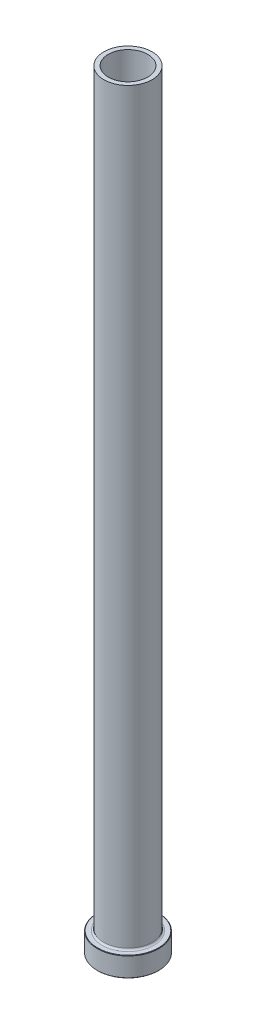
SolidWorks part; units mm, degrees
ref_plane "Front Plane" through (0, 0, 0) normal (0, 0, 1) x (1, 0, 0)
ref_plane "Top Plane" through (0, 0, 0) normal (0, 1, 0) x (1, 0, 0)
ref_plane "Right Plane" through (0, 0, 0) normal (1, 0, 0) x (0, 0, -1)
sketch "Sketch1" plane through (0, 0, 0) normal (0, 0, 1) x (1, 0, 0)
  line L0 (-9, 350) -> (-11, 350)
  line L1 (-11, 350) -> (-11, 9)
  line L2 (-11, 9) -> (-14, 9)
  line L3 (-14, 9) -> (-14, 0)
  line L4 (15.4, 0) -> (-15.4, 0) construction
  line L5 (-14, 0) -> (-9.25, 0)
  line L6 (-9, 295) -> (-9, 350)
  line L7 (0, 92.1877) -> (0, -15.5353) construction
  line L8 (0, -15.4) -> (0, 15.4) construction
  line L9 (-9, 295) -> (-9.25, 283)
  line L10 (-9.25, 283) -> (-9.25, 0)
  dimension "D1" = 0.25
  dimension "ID" = 18
  dimension "OD" = 22
  dimension "L" = 350
  dimension "H" = 28
  dimension "T" = 9
  dimension "N" = 55
  dimension "D2" = 12
revolve "Revolve1" add sketch "Sketch1" angle 360 about L7
fillet "Fillet1" radius 0.8 1 edges at (0, 9, 11)
chamfer "Chamfer1" distance 0.2 angle 45 2 edges at (0, 9, 14) (0, 0, 14)
chamfer "Chamfer3" distance 0.5 angle 45 1 edges at (0, 0, 9.25)
